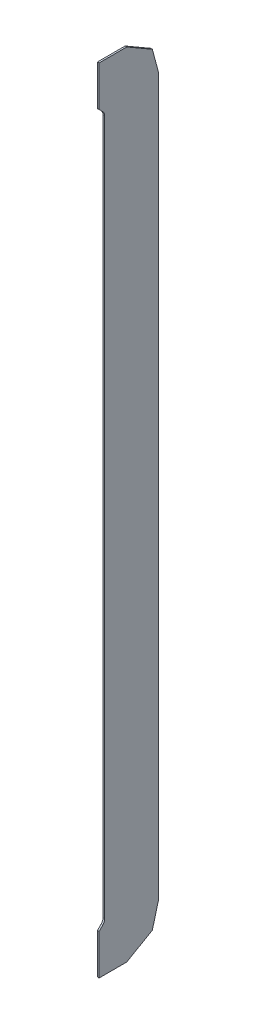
SolidWorks part; units mm, degrees
ref_plane "Front Plane" through (0, 0, 0) normal (1, 0, 0) x (0, 1, 0)
ref_plane "Top Plane" through (0, 0, 0) normal (0, 0, 1) x (0, 1, 0)
ref_plane "Right Plane" through (0, 0, 0) normal (0, 1, 0) x (-1, 0, 0)
sketch "Sketch1" plane through (0, 0, 0) normal (0, 1, 0) x (-1, 0, 0)
  line L1 (-19.05, 673.0062) -> (19.05, 673.0062)
  line L2 (-19.05, 673.0062) -> (-19.05, -673.0063)
  line L3 (-19.05, -673.0063) -> (19.05, -673.0063)
  line L4 (19.05, 673.0062) -> (19.05, -673.0063)
  line L5 (-19.05, 673.0062) -> (19.05, -673.0063) construction
  line L6 (-19.05, -673.0063) -> (19.05, 673.0062) construction
  point P0 (0, 0)
  dimension "D1" = 1346.0125
  dimension "D2" = 38.1
extrude "Boss-Extrude1" add sketch "Sketch1" along normal mid plane 17946.825
ref_plane "Mating plane" through (0, 0, -923.0063) normal (0, 0, -1) x (0, 1, 0)
sketch "Sketch3" plane through (0, 0, 0) normal (1, 0, 0) x (0, 1, 0)
  line L7 (0, -20.955) -> (0, 20.955) construction
  line L10 (8973.4125, 673.0062) -> (8973.4125, -673.0063) construction
  line L11 (8973.4125, -673.0063) -> (-8973.4125, -673.0063) construction
  line B0 (8973.4125, 659.7573) -> (8973.4125, 47.4265)
  line B1 (8973.4125, 47.4265) -> (8638.8868, -531.9889)
  line B2 (8638.8868, -531.9889) -> (8004.0147, -702.1024)
  line B3 (8004.0147, -702.1024) -> (8004.0147, -923.0063)
  line B4 (8973.4125, 659.7573) -> (9456.1121, 659.7573)
  line B5 (9456.1121, 659.7573) -> (9456.1121, -923.0063)
  line B6 (9456.1121, -923.0063) -> (8004.0147, -923.0063)
  line B7 (8004.0147, -702.1024) -> (7953.6187, -673.0063)
  line B8 (7953.6187, -673.0063) -> (7849.7025, -673.0062)
  line B9 (-8973.4125, 659.7573) -> (-8973.4125, 47.4265)
  line B10 (-8973.4125, 47.4265) -> (-8638.8868, -531.9889)
  line B11 (-8638.8868, -531.9889) -> (-8004.0147, -702.1024)
  line B12 (-8004.0147, -702.1024) -> (-8004.0147, -923.0063)
  line B13 (-8973.4125, 659.7573) -> (-9456.1121, 659.7573)
  line B14 (-9456.1121, 659.7573) -> (-9456.1121, -923.0063)
  line B15 (-9456.1121, -923.0063) -> (-8004.0147, -923.0063)
  line B16 (-8004.0147, -702.1024) -> (-7953.6187, -673.0063)
  line B17 (-7953.6187, -673.0063) -> (-7849.7025, -673.0062)
sketch_block_instance "Block1-3"
sketch_block "Block1"
sketch_block_instance "Block1-5"
extrude "Cut-Extrude2" cut sketch "Sketch3" against normal through all both and the other way through all contours B14 B15 B12 B11 B10 B9 B13 | B6 B5 B4 B0 B1 B2 B3
sketch "Sketch4" plane through (0, 0, 0) normal (1, 0, 0) x (0, 1, 0)
  line L0 (-7867.9969, 546.1937) -> (7867.9969, 546.1937)
  line L1 (8112.603, -673.0063) -> (-8112.603, -673.0063) construction
  line L2 (-8059.0125, 673.0062) -> (-7977.5984, 591.5922)
  line L3 (-8059.0125, 673.0062) -> (8059.0125, 673.0062)
  line L4 (8059.0125, 673.0062) -> (7977.5984, 591.5922)
  line L5 (-8973.4125, 673.0062) -> (-8973.4125, 47.4265) construction
  line L6 (8973.4125, 673.0062) -> (8973.4125, 47.4265) construction
  line L7 (8973.4125, 673.0062) -> (-8973.4125, 673.0062) construction
  arc A0 (7867.9969, 546.1937) -> (7977.5984, 591.5922) centre (7867.9969, 701.1937) ccw
  arc A1 (-7867.9969, 546.1937) -> (-7977.5984, 591.5922) centre (-7867.9969, 701.1937) cw
  dimension "D6" = 155
  dimension "D1" = 1219.2
  dimension "D2" = 914.4
  dimension "D3" = 914.4
  dimension "D4" = 45
  dimension "D5" = 45
extrude "Cut-Extrude3" cut sketch "Sketch4" against normal through all both and the other way through all
